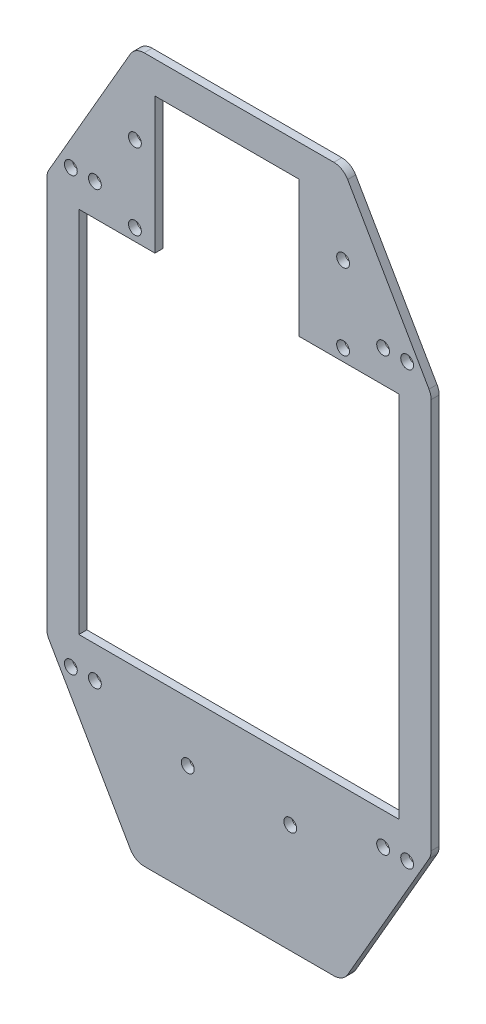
SolidWorks part; units mm, degrees
ref_plane "前视基准面" through (0, 0, 0) normal (0, 0, 1) x (1, 0, 0)
ref_plane "上视基准面" through (0, 0, 0) normal (0, 1, 0) x (1, 0, 0)
ref_plane "右视基准面" through (0, 0, 0) normal (1, 0, 0) x (0, 0, -1)
sketch "草图1" plane through (0, 0, 0) normal (0, 0, 1) x (1, 0, 0)
  line L0 (-98.6603, 121.6667) -> (-56.3212, 195)
  line L1 (47.661, 200) -> (-47.661, 200)
  line L2 (100, 116.6667) -> (100, -116.6667)
  line L3 (47.661, -200) -> (-47.661, -200)
  line L4 (-100, 116.6667) -> (-100, -116.6667)
  line L5 (-118.6603, 127.0257) -> (-67.8682, 215)
  line L6 (59.208, 220) -> (-59.208, 220)
  line L7 (0, 0) -> (0, 150) construction
  line L8 (0, 0) -> (100, 0) construction
  line L9 (98.6603, 121.6667) -> (56.3212, 195)
  line L10 (98.6603, -121.6667) -> (56.3212, -195)
  line L11 (-98.6603, -121.6667) -> (-56.3212, -195)
  line L12 (118.6603, 127.0257) -> (67.8682, 215)
  line L13 (120, 122.0257) -> (120, -122.0257)
  line L14 (118.6603, -127.0257) -> (67.8682, -215)
  line L15 (59.208, -220) -> (-59.208, -220)
  line L16 (-118.6603, -127.0257) -> (-67.8682, -215)
  line L17 (-120, 122.0257) -> (-120, -122.0257)
  line L18 (-120, -124.7051) -> (-64.9815, -220) construction
  line L19 (-120, 124.7051) -> (-120, -124.7051) construction
  line L20 (64.9815, -220) -> (-64.9815, -220) construction
  line L21 (120, -124.7051) -> (64.9815, -220) construction
  line L22 (120, 124.7051) -> (120, -124.7051) construction
  line L23 (-100, -119.3462) -> (-53.4345, -200) construction
  line L24 (53.4345, -200) -> (-53.4345, -200) construction
  line L25 (-100, 119.3462) -> (-100, -119.3462) construction
  line L26 (100, -119.3462) -> (53.4345, -200) construction
  line L27 (100, 119.3462) -> (100, -119.3462) construction
  line L28 (100, 119.3462) -> (53.4345, 200) construction
  line L29 (53.4345, 200) -> (-53.4345, 200) construction
  line L30 (-100, 119.3462) -> (-53.4345, 200) construction
  line L31 (120, 124.7051) -> (64.9815, 220) construction
  line L32 (64.9815, 220) -> (-64.9815, 220) construction
  line L33 (-120, 124.7051) -> (-64.9815, 220) construction
  arc A0 (-118.6603, -127.0257) -> (-120, -122.0257) centre (-110, -122.0257) cw
  arc A1 (-59.208, -220) -> (-67.8682, -215) centre (-59.208, -210) cw
  arc A2 (67.8682, -215) -> (59.208, -220) centre (59.208, -210) cw
  arc A3 (120, -122.0257) -> (118.6603, -127.0257) centre (110, -122.0257) cw
  arc A4 (-56.3212, -195) -> (-47.661, -200) centre (-47.661, -190) ccw
  arc A5 (-98.6603, -121.6667) -> (-100, -116.6667) centre (-90, -116.6667) cw
  arc A6 (56.3212, -195) -> (47.661, -200) centre (47.661, -190) cw
  arc A7 (98.6603, -121.6667) -> (100, -116.6667) centre (90, -116.6667) ccw
  arc A8 (56.3212, 195) -> (47.661, 200) centre (47.661, 190) ccw
  arc A9 (98.6603, 121.6667) -> (100, 116.6667) centre (90, 116.6667) cw
  arc A10 (-56.3212, 195) -> (-47.661, 200) centre (-47.661, 190) cw
  arc A11 (-98.6603, 121.6667) -> (-100, 116.6667) centre (-90, 116.6667) ccw
  arc A12 (118.6603, 127.0257) -> (120, 122.0257) centre (110, 122.0257) cw
  arc A13 (59.208, 220) -> (67.8682, 215) centre (59.208, 210) cw
  arc A14 (-67.8682, 215) -> (-59.208, 220) centre (-59.208, 210) cw
  arc A15 (-118.6603, 127.0257) -> (-120, 122.0257) centre (-110, 122.0257) ccw
  point P0 (0, 0)
  point P37 (-53.4345, -200)
  point P50 (53.4345, 200)
  dimension "D6" = 10
  dimension "D7" = 73.3333
  dimension "D1" = 400
  dimension "D2" = 200
  dimension "D3" = 100
  dimension "D4" = 200
  dimension "D5" = 20
  dimension "D8" = 30
  dimension "D9" = 73.3333
  dimension "D10" = 30
extrude "凸台-拉伸1" add sketch "草图1" along normal blind 30
sketch "草图2" plane through (0, 0, 30) normal (0, 0, 1) x (1, 0, 0)
  line L0 (-100, 130) -> (-70, 130)
  line L1 (-100, 116.6667) -> (-100, -116.6667) construction
  line L2 (-70, 130) -> (-70, 200)
  line L3 (47.661, 200) -> (-47.661, 200) construction
  line L4 (-70, 200) -> (-37.5, 200)
  line L5 (-37.5, 200) -> (-37.5, 115)
  line L6 (-37.5, 115) -> (-100, 115)
  line L7 (-100, 115) -> (-100, 130)
  line L8 (0, 0) -> (0, 200) construction
  dimension "D1" = 15
  dimension "D2" = 32.5
  dimension "D3" = 37.5
  dimension "D4" = 115
extrude "凸台-拉伸2" add sketch "草图2" against normal blind 40
mirror "镜向1" about plane through (0, 0, 0) normal (0, 1, 0) of "凸台-拉伸2"
mirror "镜向2" about plane through (0, 0, 0) normal (1, 0, 0) of "凸台-拉伸2", "镜向1"
sketch "草图3" plane through (0, 0, 0) normal (0, 0, -1) x (-1, 0, 0)
  line L0 (-100, 115) -> (100, 115)
  line L1 (100, 115) -> (100, -115)
  line L2 (100, -115) -> (-100, -115)
  line L3 (-100, -115) -> (-100, 115)
  line L8 (120, -122.0257) -> (120, 122.0257)
  line L10 (120, -122.0257) -> (120, 122.0257)
  line L12 (-120, 122.0257) -> (-120, -122.0257)
  line L13 (-118.6603, -127.0257) -> (-67.8682, -215)
  line L14 (118.6603, 127.0257) -> (67.8682, 215)
  line L20 (-120, 122.0257) -> (-120, -122.0257)
  line L21 (-118.6603, -127.0257) -> (-67.8682, -215)
  line L28 (118.6603, 127.0257) -> (67.8682, 215)
  line L29 (59.208, 220) -> (-59.208, 220)
  line L30 (59.208, 220) -> (-59.208, 220)
  line L31 (-67.8682, 215) -> (-118.6603, 127.0257)
  line L32 (-67.8682, 215) -> (-118.6603, 127.0257)
  line L34 (-59.208, -220) -> (59.208, -220)
  line L36 (-59.208, -220) -> (59.208, -220)
  line L38 (67.8682, -215) -> (118.6603, -127.0257)
  line L40 (67.8682, -215) -> (118.6603, -127.0257)
  arc A8 (118.6603, -127.0257) -> (120, -122.0257) centre (110, -122.0257) ccw
  arc A9 (118.6603, -127.0257) -> (120, -122.0257) centre (110, -122.0257) ccw
  arc A10 (120, 122.0257) -> (118.6603, 127.0257) centre (110, 122.0257) ccw
  arc A11 (120, 122.0257) -> (118.6603, 127.0257) centre (110, 122.0257) ccw
  arc A12 (-118.6603, 127.0257) -> (-120, 122.0257) centre (-110, 122.0257) ccw
  arc A13 (-120, -122.0257) -> (-118.6603, -127.0257) centre (-110, -122.0257) ccw
  arc A14 (67.8682, 215) -> (59.208, 220) centre (59.208, 210) ccw
  arc A15 (67.8682, 215) -> (59.208, 220) centre (59.208, 210) ccw
  arc A20 (-118.6603, 127.0257) -> (-120, 122.0257) centre (-110, 122.0257) ccw
  arc A21 (-120, -122.0257) -> (-118.6603, -127.0257) centre (-110, -122.0257) ccw
  arc A24 (-59.208, 220) -> (-67.8682, 215) centre (-59.208, 210) ccw
  arc A25 (-59.208, 220) -> (-67.8682, 215) centre (-59.208, 210) ccw
  arc A26 (-67.8682, -215) -> (-59.208, -220) centre (-59.208, -210) ccw
  arc A27 (-67.8682, -215) -> (-59.208, -220) centre (-59.208, -210) ccw
  arc A28 (59.208, -220) -> (67.8682, -215) centre (59.208, -210) ccw
  arc A29 (59.208, -220) -> (67.8682, -215) centre (59.208, -210) ccw
  dimension "D1" = 0
extrude "凸台-拉伸3" add sketch "草图3" along normal blind 20
sketch "草图5" plane through (0, 0, -20) normal (0, 0, -1) x (-1, 0, 0)
  line L0 (-67.8682, 215) -> (-67.8682, 310)
  line L1 (-67.8682, 310) -> (67.8682, 310)
  line L2 (67.8682, 310) -> (67.8682, 215)
  line L3 (59.208, 220) -> (-59.208, 220) construction
  line L4 (59.208, 220) -> (-59.208, 220)
  arc A0 (67.8682, 215) -> (59.208, 220) centre (59.208, 210) ccw construction
  arc A1 (-59.208, 220) -> (-67.8682, 215) centre (-59.208, 210) ccw construction
  arc A2 (67.8682, 215) -> (59.208, 220) centre (59.208, 210) ccw
  arc A3 (-59.208, 220) -> (-67.8682, 215) centre (-59.208, 210) ccw
  dimension "D1" = 90
extrude "凸台-拉伸11" add sketch "草图5" against normal blind 15 from offset 10
fillet "圆角3" radius 5 2 edges at (67.8682, 310, -2.5) (-67.8682, 310, -2.5)
sketch "草图6" plane through (0, 0, 0) normal (1, 0, 0) x (0, 0, -1)
  line L0 (-30, 220) -> (-5, 220) construction
  line L1 (17, 221) -> (-5, 221)
  line L2 (17, 221) -> (17, 199)
  line L3 (17, 199) -> (-5, 199)
  line L4 (-5, 221) -> (-5, 199)
  line L5 (17, 221) -> (-5, 199) construction
  line L6 (17, 199) -> (-5, 221) construction
  line L7 (-30, 127.0257) -> (-30, 215) construction
  point P0 (6, 210)
  dimension "D1" = 22
  dimension "D2" = 10
  dimension "D3" = 22
  dimension "D4" = 25
extrude "凸台-拉伸12" add sketch "草图6" along normal mid plane 450
sketch "草图10" plane through (0, 0, 30) normal (0, 0, 1) x (1, 0, 0)
  line L0 (-65, 122.5) -> (-65, 170) construction
  line L2 (-100, 115) -> (-37.5, 115) construction
  dimension "D1" = 65
  dimension "D2" = 7.5
  dimension "D3" = 47.5
hole_wizard "M8x1.0 螺纹孔1" positions "3D草图1" profile "草图11" tap size "M8x1.0" standard "GB"
sketch3d "3D草图1"
  point P0 (-65, 122.5, 30)
  point P3 (-65, 170, 30)
sketch "草图11" plane through (-65, 122.5, 30) normal (1, 0, 0) x (0, -1, 0)
  line L0 (0, 0) -> (0, 23.103)
  line L1 (0, 23.103) -> (3.5, 21)
  line L2 (3.5, 21) -> (3.5, 0)
  line L5 (3.5, 0) -> (0, 0)
  line L10 (0, 23.103) -> (-3.5, 21) construction
  line L11 (0, -6.35) -> (0, 107.95) construction
  dimension "螺纹孔钻头直径" = 7
  dimension "螺纹孔钻头深度" = 21
  dimension "导头角度" = 118
mirror "镜向7" about plane through (0, 0, 0) normal (1, 0, 0) of "M8x1.0 螺纹孔1"
sketch "草图14" plane through (0, 0, 0) normal (0, 0, 1) x (1, 0, 0)
  line L0 (-37.5, 200) -> (37.5, 200)
  line L1 (37.5, 200) -> (37.5, 199)
  line L2 (37.5, 199) -> (-37.5, 199)
  line L3 (-37.5, 199) -> (-37.5, 200)
extrude "切除-拉伸1" cut sketch "草图14" along normal blind 10
mirror "镜向8" about plane through (0, 0, 0) normal (0, 1, 0) of "切除-拉伸1", "凸台-拉伸12", "凸台-拉伸11"
sketch "草图15" plane through (0, 0, 5) normal (0, 0, 1) x (1, 0, 0)
  line L0 (225, 210) -> (191, 210) construction
  line L1 (194, 213) -> (188, 213)
  line L2 (194, 213) -> (194, 207)
  line L3 (194, 207) -> (188, 207)
  line L4 (188, 213) -> (188, 207)
  line L5 (194, 213) -> (188, 207) construction
  line L6 (194, 207) -> (188, 213) construction
  line L7 (225, 221) -> (225, 199) construction
  line L8 (191, 210) -> (176, 210) construction
  line L10 (179, 213) -> (173, 213)
  line L11 (179, 213) -> (179, 207)
  line L12 (179, 207) -> (173, 207)
  line L13 (173, 213) -> (173, 207)
  line L14 (179, 213) -> (173, 207) construction
  line L15 (179, 207) -> (173, 213) construction
  point P0 (191, 210)
  dimension "D1" = 6
  dimension "D2" = 6
  dimension "D3" = 34
  dimension "D4" = 15
  dimension "D5" = 6
  dimension "D6" = 6
sketch "草图16" plane through (0, 0, 5) normal (0, 0, 1) x (1, 0, 0)
  line L0 (135, 199) -> (135, -199)
  line L1 (225, 199) -> (77.1058, 199) construction
  line L2 (225, -199) -> (77.1058, -199) construction
  line L3 (135, -199) -> (77.1058, -199)
  line L4 (77.1058, -199) -> (118.6603, -127.0257)
  line L5 (120, -122.0257) -> (120, 122.0257) construction
  line L6 (120, -122.0257) -> (120, 122.0257)
  line L7 (118.6603, 127.0257) -> (67.8682, 215) construction
  line L8 (118.6603, 127.0257) -> (77.1058, 199)
  line L9 (135, 199) -> (77.1058, 199)
  line L10 (0, 0) -> (0, -200) construction
  line L11 (-37.5, -200) -> (37.5, -200) construction
  line L12 (-135, 199) -> (-77.1058, 199)
  line L13 (-118.6603, 127.0257) -> (-77.1058, 199)
  line L14 (-120, -122.0257) -> (-120, 122.0257)
  line L15 (-77.1058, -199) -> (-118.6603, -127.0257)
  line L16 (-135, -199) -> (-77.1058, -199)
  line L17 (-135, 199) -> (-135, -199)
  arc A0 (118.6603, -127.0257) -> (120, -122.0257) centre (110, -122.0257) ccw construction
  arc A1 (118.6603, -127.0257) -> (120, -122.0257) centre (110, -122.0257) ccw
  arc A2 (120, 122.0257) -> (118.6603, 127.0257) centre (110, 122.0257) ccw construction
  arc A3 (120, 122.0257) -> (118.6603, 127.0257) centre (110, 122.0257) ccw
  arc A4 (-120, 122.0257) -> (-118.6603, 127.0257) centre (-110, 122.0257) cw
  arc A5 (-118.6603, -127.0257) -> (-120, -122.0257) centre (-110, -122.0257) cw
  dimension "D1" = 15
extrude "凸台-拉伸13" add sketch "草图16" against normal blind 20 from offset 1
sketch "草图17" plane through (0, 0, 4) normal (0, 0, 1) x (1, 0, 0)
  line L0 (105.9734, 199) -> (135, 148.7244)
  line L1 (135, 199) -> (77.1058, 199) construction
  line L2 (135, -199) -> (135, 199) construction
  line L3 (135, 148.7244) -> (135, 199)
  line L4 (225, 199) -> (77.1058, 199) construction
  line L5 (135, 199) -> (105.9734, 199)
  line L6 (77.1058, 199) -> (118.6603, 127.0257) construction
  line L7 (118.6603, 127.0257) -> (67.8682, 215) construction
  line L8 (0, 0) -> (308.3014, 0) construction
  line L9 (135, -199) -> (105.9734, -199)
  line L10 (135, -148.7244) -> (135, -199)
  line L11 (105.9734, -199) -> (135, -148.7244)
  line L12 (0, 0) -> (0, -200) construction
  line L13 (-37.5, -200) -> (37.5, -200) construction
  line L14 (-105.9734, -199) -> (-135, -148.7244)
  line L15 (-135, -148.7244) -> (-135, -199)
  line L16 (-135, -199) -> (-105.9734, -199)
  line L17 (-135, 199) -> (-105.9734, 199)
  line L18 (-135, 148.7244) -> (-135, 199)
  line L19 (-105.9734, 199) -> (-135, 148.7244)
  dimension "D1" = 25
extrude "切除-拉伸3" cut sketch "草图17" against normal blind 20
fillet "圆角4" radius 5 8 edges at (105.9734, -199, -6) (135, -148.7244, -6) (135, 148.7244, -6) (105.9734, 199, -6) (-105.9734, 199, -6) (-135, 148.7244, -6) (-135, -148.7244, -6) (-105.9734, -199, -6)
sketch "草图18" plane through (225, 0, 0) normal (1, 0, 0) x (0, 0, -1)
  line L0 (-5, 199) -> (17, 199) construction
  line L1 (8, 203) -> (4, 203)
  line L2 (8, 203) -> (8, 195)
  line L3 (8, 195) -> (4, 195)
  line L4 (4, 203) -> (4, 195)
  line L5 (8, 203) -> (4, 195) construction
  line L6 (8, 195) -> (4, 203) construction
  point P0 (6, 199)
  dimension "D1" = 8
  dimension "D2" = 4
sketch "草图19" plane through (0, 0, 30) normal (0, 0, 1) x (1, 0, 0)
  line L3 (-93.849, 130) -> (-70, 130)
  line L4 (-70, 130) -> (-70, 171.3077)
  line L5 (-70, 171.3077) -> (-93.849, 130)
  line L6 (-93.849, 130) -> (-70, 130)
  line L7 (-70, 130) -> (-70, 171.3077)
  line L8 (-70, 171.3077) -> (-93.849, 130)
  line L9 (93.849, 130) -> (70, 171.3077)
  line L10 (70, 171.3077) -> (70, 130)
  line L11 (70, 130) -> (93.849, 130)
  line L12 (93.849, 130) -> (70, 171.3077)
  line L13 (70, 171.3077) -> (70, 130)
  line L14 (70, 130) -> (93.849, 130)
  line L15 (93.849, -130) -> (70, -130)
  line L16 (70, -130) -> (70, -171.3077)
  line L17 (70, -171.3077) -> (93.849, -130)
  line L18 (93.849, -130) -> (70, -130)
  line L19 (70, -130) -> (70, -171.3077)
  line L20 (70, -171.3077) -> (93.849, -130)
  line L21 (-93.849, -130) -> (-70, -171.3077)
  line L22 (-70, -171.3077) -> (-70, -130)
  line L23 (-70, -130) -> (-93.849, -130)
  line L24 (-93.849, -130) -> (-70, -171.3077)
  line L25 (-70, -171.3077) -> (-70, -130)
  line L26 (-70, -130) -> (-93.849, -130)
  dimension "D1" = 0
  dimension "D2" = 0
  dimension "D3" = 0
  dimension "D4" = 0
extrude "凸台-拉伸14" add sketch "草图19" against normal up to next
sketch "草图20" plane through (0, 0, -20) normal (0, 0, -1) x (-1, 0, 0)
  line L1 (-100, 115) -> (100, 115)
  line L2 (-100, 115) -> (-100, -115)
  line L3 (-100, -115) -> (100, -115)
  line L4 (100, 115) -> (100, -115)
  line L8 (120, -122.0257) -> (120, 122.0257)
  line L9 (118.6603, 127.0257) -> (67.8682, 215)
  line L10 (59.208, 220) -> (-59.208, 220)
  line L11 (-67.8682, 215) -> (-118.6603, 127.0257)
  line L12 (-120, 122.0257) -> (-120, -122.0257)
  line L13 (-118.6603, -127.0257) -> (-67.8682, -215)
  line L14 (-59.208, -220) -> (59.208, -220)
  line L15 (67.8682, -215) -> (118.6603, -127.0257)
  line L16 (120, -122.0257) -> (120, 122.0257)
  line L17 (118.6603, 127.0257) -> (67.8682, 215)
  line L18 (59.208, 220) -> (-59.208, 220)
  line L19 (-67.8682, 215) -> (-118.6603, 127.0257)
  line L20 (-120, 122.0257) -> (-120, -122.0257)
  line L21 (-118.6603, -127.0257) -> (-67.8682, -215)
  line L22 (-59.208, -220) -> (59.208, -220)
  line L23 (67.8682, -215) -> (118.6603, -127.0257)
  arc A8 (118.6603, -127.0257) -> (120, -122.0257) centre (110, -122.0257) ccw
  arc A9 (120, 122.0257) -> (118.6603, 127.0257) centre (110, 122.0257) ccw
  arc A10 (67.8682, 215) -> (59.208, 220) centre (59.208, 210) ccw
  arc A11 (-59.208, 220) -> (-67.8682, 215) centre (-59.208, 210) ccw
  arc A12 (-118.6603, 127.0257) -> (-120, 122.0257) centre (-110, 122.0257) ccw
  arc A13 (-120, -122.0257) -> (-118.6603, -127.0257) centre (-110, -122.0257) ccw
  arc A14 (-67.8682, -215) -> (-59.208, -220) centre (-59.208, -210) ccw
  arc A15 (59.208, -220) -> (67.8682, -215) centre (59.208, -210) ccw
  arc A16 (118.6603, -127.0257) -> (120, -122.0257) centre (110, -122.0257) ccw
  arc A17 (120, 122.0257) -> (118.6603, 127.0257) centre (110, 122.0257) ccw
  arc A18 (67.8682, 215) -> (59.208, 220) centre (59.208, 210) ccw
  arc A19 (-59.208, 220) -> (-67.8682, 215) centre (-59.208, 210) ccw
  arc A20 (-118.6603, 127.0257) -> (-120, 122.0257) centre (-110, 122.0257) ccw
  arc A21 (-120, -122.0257) -> (-118.6603, -127.0257) centre (-110, -122.0257) ccw
  arc A22 (-67.8682, -215) -> (-59.208, -220) centre (-59.208, -210) ccw
  arc A23 (59.208, -220) -> (67.8682, -215) centre (59.208, -210) ccw
  dimension "D1" = 0
extrude "凸台-拉伸15" add sketch "草图20" along normal blind 5
sketch "草图22" plane through (67.8682, 0, 0) normal (1, 0, 0) x (0, 0, -1)
  line L0 (10, 305) -> (10, 221) construction
  line L1 (10, 262) -> (0, 262)
  line L2 (10, 262) -> (10, 290)
  line L3 (10, 290) -> (0, 290)
  line L4 (0, 262) -> (0, 290)
  line L5 (-5, 310) -> (10, 310) construction
  line L6 (0, 264) -> (10, 266)
  line L7 (10, 272) -> (0, 274)
  line L8 (0, 276) -> (10, 276) construction
  line L9 (10, 280) -> (0, 278)
  line L10 (0, 288) -> (10, 286)
  dimension "D1" = 10
  dimension "D2" = 28
  dimension "D3" = 20
  dimension "D4" = 4
  dimension "D5" = 4
  dimension "D6" = 2
  dimension "D7" = 10
sketch "草图24" plane through (0, 0, 0) normal (0, 0, 1) x (1, 0, 0)
  line L4 (-37.5, -115) -> (-37.5, -200)
  line L7 (37.5, -115) -> (-37.5, -115)
  line L11 (37.5, -115) -> (-37.5, -115)
  line L16 (-37.5, -115) -> (-37.5, -200)
  line L19 (-37.5, -200) -> (37.5, -200)
  line L21 (-37.5, -200) -> (37.5, -200)
  line L22 (37.5, -200) -> (37.5, -115)
  line L23 (37.5, -200) -> (37.5, -115)
  dimension "D1" = 0
extrude "凸台-拉伸16" add sketch "草图24" along normal up to surface (30 mm away)
sketch "草图25" plane through (0, -115, 0) normal (0, 1, 0) x (1, 0, 0)
  line L0 (0, -30) -> (0, 22) construction
  line L1 (-100, -30) -> (100, -30) construction
  dimension "D1" = 52
hole_wizard "M8 螺纹孔1" positions "3D草图2" profile "草图26" tap size "M8" standard "GB"
sketch3d "3D草图2"
  point P0 (0, -115, -22)
sketch "草图26" plane through (0, -115, -22) normal (1, 0, 0) x (0, 0, 1)
  line L0 (0, 0) -> (0, 22.0429)
  line L1 (0, 22.0429) -> (3.4, 20)
  line L2 (3.4, 20) -> (3.4, 0)
  line L5 (3.4, 0) -> (0, 0)
  line L10 (0, 22.0429) -> (-3.4, 20) construction
  line L11 (0, -6.35) -> (0, 107.95) construction
  dimension "螺纹孔钻头直径" = 6.8
  dimension "螺纹孔钻头深度" = 20
  dimension "导头角度" = 118
sketch "草图27" plane through (0, 0, 30) normal (0, 0, 1) x (1, 0, 0)
  line L0 (-16, -115) -> (-16, -105)
  line L1 (-100, -115) -> (100, -115) construction
  line L2 (-16, -105) -> (16, -105)
  line L3 (0, -105) -> (0, -111) construction
  line L4 (12, -111) -> (-12, -111)
  line L5 (-12, -111) -> (-12, -115)
  line L6 (-12, -115) -> (-16, -115)
  line L7 (0, 0) -> (0, -105) construction
  line L8 (12, -115) -> (16, -115)
  line L9 (12, -111) -> (12, -115)
  line L10 (16, -115) -> (16, -105)
  dimension "D1" = 6
  dimension "D2" = 10
  dimension "D3" = 12
  dimension "D4" = 16
extrude "凸台-拉伸17" add sketch "草图27" against normal blind 5 from offset 12
pattern_linear "阵列(线性)2" count 2 spacing 26 along (0, 0, -1) of "凸台-拉伸17"
sketch "草图28" plane through (0, 0, 30) normal (0, 0, 1) x (1, 0, 0)
  line L0 (0, -115) -> (0, -152) construction
  line L1 (-100, -115) -> (100, -115) construction
  line L2 (0, -152) -> (-32, -152) construction
  line L3 (0, -152) -> (32, -152) construction
  dimension "D1" = 37
  dimension "D2" = 32
  dimension "D3" = 32
hole_wizard "M8 螺纹孔2" positions "3D草图3" profile "草图29" tap size "M8" standard "GB"
sketch3d "3D草图3"
  point P0 (-32, -152, 30)
  point P3 (32, -152, 30)
sketch "草图29" plane through (-32, -152, 30) normal (1, 0, 0) x (0, -1, 0)
  line L0 (0, 0) -> (0, 24.5429)
  line L1 (0, 24.5429) -> (3.4, 22.5)
  line L2 (3.4, 22.5) -> (3.4, 0)
  line L5 (3.4, 0) -> (0, 0)
  line L10 (0, 24.5429) -> (-3.4, 22.5) construction
  line L11 (0, -6.35) -> (0, 107.95) construction
  dimension "螺纹孔钻头直径" = 6.8
  dimension "螺纹孔钻头深度" = 22.5
  dimension "导头角度" = 118
sketch "草图30" plane through (-67.8682, 0, 0) normal (-1, 0, 0) x (0, 0, 1)
  line L0 (-10, -310) -> (-38.263, -300.579)
  line L1 (-57.2367, -297.5) -> (-125, -297.5)
  line L2 (-127.5, -295) -> (-127.5, -290)
  line L3 (-125, -287.5) -> (-10, -287.5)
  line L4 (-10, -221) -> (-10, -310) construction
  line L5 (-10, -287.5) -> (-10, -310)
  arc A0 (-38.263, -300.579) -> (-57.2367, -297.5) centre (-57.2367, -357.5) ccw
  arc A1 (-127.5, -290) -> (-125, -287.5) centre (-125, -290) cw
  arc A2 (-125, -297.5) -> (-127.5, -295) centre (-125, -295) cw
  point P10 (-47.5, -297.5)
  point P13 (-127.5, -287.5)
  point P16 (-127.5, -297.5)
  dimension "D5" = 60
  dimension "D6" = 2.5
  dimension "D1" = 12.5
  dimension "D2" = 10
  dimension "D3" = 117.5
  dimension "D4" = 80
sketch "草图32" plane through (0, 0, 30) normal (0, 0, 1) x (1, 0, 0)
  line L0 (-37.5, 200) -> (-52.5, 200)
  line L1 (-52.5, 200) -> (-52.5, 115)
  line L2 (-100, 115) -> (-37.5, 115) construction
  line L3 (-52.5, 115) -> (-37.5, 115)
  line L4 (-37.5, 115) -> (-37.5, 200)
  dimension "D1" = 15
extrude "切除-拉伸7" cut sketch "草图32" against normal up to surface (30 mm away)
sketch "草图33" plane through (0, 0, 0) normal (0, 0, 1) x (1, 0, 0)
  line L4 (37.5, 115) -> (37.5, 200)
  line L6 (-52.5, 200) -> (-52.5, 115)
  line L7 (-52.5, 115) -> (37.5, 115)
  line L10 (-52.5, 200) -> (-52.5, 115)
  line L11 (-52.5, 115) -> (37.5, 115)
  line L12 (37.5, 115) -> (37.5, 200)
  line L14 (37.5, 200) -> (-52.5, 200)
  line L15 (37.5, 200) -> (-52.5, 200)
  dimension "D1" = 0
extrude "切除-拉伸8" cut sketch "草图33" against normal blind 12
sketch "草图34" plane through (0, 0, 30) normal (0, 0, 1) x (1, 0, 0)
  line L0 (-100, -115) -> (100, -115) construction
  line L1 (-50, -115) -> (50, -115)
  line L2 (-50, -115) -> (-50, -174)
  line L3 (-50, -174) -> (50, -174)
  line L4 (50, -115) -> (50, -174)
  line L5 (0, -174) -> (0, -220) construction
  line L6 (59.208, -220) -> (-59.208, -220) construction
  dimension "D1" = 100
  dimension "D2" = 59
extrude "切除-拉伸9" cut sketch "草图34" against normal blind 9.25
sketch "草图35" plane through (0, 0, 30) normal (0, 0, 1) x (1, 0, 0)
  line L2 (-175.1264, 290.7759) -> (175.1264, 290.7759)
  line L3 (-175.1264, 290.7759) -> (-175.1264, -290.7759)
  line L4 (-175.1264, -290.7759) -> (175.1264, -290.7759)
  line L5 (175.1264, 290.7759) -> (175.1264, -290.7759)
  line L6 (-175.1264, 290.7759) -> (175.1264, -290.7759) construction
  line L7 (-175.1264, -290.7759) -> (175.1264, 290.7759) construction
  point P2 (0, 0)
extrude "切除-拉伸10" cut sketch "草图35" against normal offset from surface (21 mm away) 5
sketch "草图40" plane through (0, 0, -25) normal (0, 0, -1) x (-1, 0, 0)
  line L1 (-294.8809, 339.2041) -> (294.8809, 339.2041)
  line L2 (-294.8809, 339.2041) -> (-294.8809, -339.2041)
  line L3 (-294.8809, -339.2041) -> (294.8809, -339.2041)
  line L4 (294.8809, 339.2041) -> (294.8809, -339.2041)
  line L5 (-294.8809, 339.2041) -> (294.8809, -339.2041) construction
  line L6 (-294.8809, -339.2041) -> (294.8809, 339.2041) construction
  point P0 (0, 0)
sketch "草图42" plane through (0, 0, -25) normal (0, 0, -1) x (-1, 0, 0)
  line L8 (120, -122.0257) -> (120, 122.0257)
  line L9 (118.6603, 127.0257) -> (67.8682, 215)
  line L10 (59.208, 220) -> (-59.208, 220)
  line L11 (-67.8682, 215) -> (-118.6603, 127.0257)
  line L12 (-120, 122.0257) -> (-120, -122.0257)
  line L13 (-118.6603, -127.0257) -> (-67.8682, -215)
  line L14 (-59.208, -220) -> (59.208, -220)
  line L15 (67.8682, -215) -> (118.6603, -127.0257)
  line L16 (120, -122.0257) -> (120, 122.0257)
  line L17 (118.6603, 127.0257) -> (67.8682, 215)
  line L18 (59.208, 220) -> (-59.208, 220)
  line L19 (-67.8682, 215) -> (-118.6603, 127.0257)
  line L20 (-120, 122.0257) -> (-120, -122.0257)
  line L21 (-118.6603, -127.0257) -> (-67.8682, -215)
  line L22 (-59.208, -220) -> (59.208, -220)
  line L23 (67.8682, -215) -> (118.6603, -127.0257)
  arc A8 (118.6603, -127.0257) -> (120, -122.0257) centre (110, -122.0257) ccw
  arc A9 (120, 122.0257) -> (118.6603, 127.0257) centre (110, 122.0257) ccw
  arc A10 (67.8682, 215) -> (59.208, 220) centre (59.208, 210) ccw
  arc A11 (-59.208, 220) -> (-67.8682, 215) centre (-59.208, 210) ccw
  arc A12 (-118.6603, 127.0257) -> (-120, 122.0257) centre (-110, 122.0257) ccw
  arc A13 (-120, -122.0257) -> (-118.6603, -127.0257) centre (-110, -122.0257) ccw
  arc A14 (-67.8682, -215) -> (-59.208, -220) centre (-59.208, -210) ccw
  arc A15 (59.208, -220) -> (67.8682, -215) centre (59.208, -210) ccw
  arc A16 (118.6603, -127.0257) -> (120, -122.0257) centre (110, -122.0257) ccw
  arc A17 (120, 122.0257) -> (118.6603, 127.0257) centre (110, 122.0257) ccw
  arc A18 (67.8682, 215) -> (59.208, 220) centre (59.208, 210) ccw
  arc A19 (-59.208, 220) -> (-67.8682, 215) centre (-59.208, 210) ccw
  arc A20 (-118.6603, 127.0257) -> (-120, 122.0257) centre (-110, 122.0257) ccw
  arc A21 (-120, -122.0257) -> (-118.6603, -127.0257) centre (-110, -122.0257) ccw
  arc A22 (-67.8682, -215) -> (-59.208, -220) centre (-59.208, -210) ccw
  arc A23 (59.208, -220) -> (67.8682, -215) centre (59.208, -210) ccw
  dimension "D1" = 0
sketch "草图43" plane through (0, 0, -25) normal (0, 0, -1) x (-1, 0, 0)
  line L1 (-227.3114, 369.6277) -> (227.3114, 369.6277)
  line L2 (-227.3114, 369.6277) -> (-227.3114, -369.6277)
  line L3 (-227.3114, -369.6277) -> (227.3114, -369.6277)
  line L4 (227.3114, 369.6277) -> (227.3114, -369.6277)
  line L5 (-227.3114, 369.6277) -> (227.3114, -369.6277) construction
  line L6 (-227.3114, -369.6277) -> (227.3114, 369.6277) construction
  line L8 (120, -122.0257) -> (120, 122.0257)
  line L9 (118.6603, 127.0257) -> (67.8682, 215)
  line L10 (59.208, 220) -> (-59.208, 220)
  line L11 (-67.8682, 215) -> (-118.6603, 127.0257)
  line L12 (-120, 122.0257) -> (-120, -122.0257)
  line L13 (-118.6603, -127.0257) -> (-67.8682, -215)
  line L14 (-59.208, -220) -> (59.208, -220)
  line L15 (67.8682, -215) -> (118.6603, -127.0257)
  line L16 (120, -122.0257) -> (120, 122.0257)
  line L17 (118.6603, 127.0257) -> (67.8682, 215)
  line L18 (59.208, 220) -> (-59.208, 220)
  line L19 (-67.8682, 215) -> (-118.6603, 127.0257)
  line L20 (-120, 122.0257) -> (-120, -122.0257)
  line L21 (-118.6603, -127.0257) -> (-67.8682, -215)
  line L22 (-59.208, -220) -> (59.208, -220)
  line L23 (67.8682, -215) -> (118.6603, -127.0257)
  arc A8 (118.6603, -127.0257) -> (120, -122.0257) centre (110, -122.0257) ccw
  arc A9 (120, 122.0257) -> (118.6603, 127.0257) centre (110, 122.0257) ccw
  arc A10 (67.8682, 215) -> (59.208, 220) centre (59.208, 210) ccw
  arc A11 (-59.208, 220) -> (-67.8682, 215) centre (-59.208, 210) ccw
  arc A12 (-118.6603, 127.0257) -> (-120, 122.0257) centre (-110, 122.0257) ccw
  arc A13 (-120, -122.0257) -> (-118.6603, -127.0257) centre (-110, -122.0257) ccw
  arc A14 (-67.8682, -215) -> (-59.208, -220) centre (-59.208, -210) ccw
  arc A15 (59.208, -220) -> (67.8682, -215) centre (59.208, -210) ccw
  arc A16 (118.6603, -127.0257) -> (120, -122.0257) centre (110, -122.0257) ccw
  arc A17 (120, 122.0257) -> (118.6603, 127.0257) centre (110, 122.0257) ccw
  arc A18 (67.8682, 215) -> (59.208, 220) centre (59.208, 210) ccw
  arc A19 (-59.208, 220) -> (-67.8682, 215) centre (-59.208, 210) ccw
  arc A20 (-118.6603, 127.0257) -> (-120, 122.0257) centre (-110, 122.0257) ccw
  arc A21 (-120, -122.0257) -> (-118.6603, -127.0257) centre (-110, -122.0257) ccw
  arc A22 (-67.8682, -215) -> (-59.208, -220) centre (-59.208, -210) ccw
  arc A23 (59.208, -220) -> (67.8682, -215) centre (59.208, -210) ccw
  point P0 (0, 0)
  dimension "D1" = 0
sketch "草图45" plane through (0, 0, -25) normal (0, 0, -1) x (-1, 0, 0)
  line L1 (-183.5965, 287.6082) -> (183.5965, 287.6082)
  line L2 (-183.5965, 287.6082) -> (-183.5965, -287.6082)
  line L3 (-183.5965, -287.6082) -> (183.5965, -287.6082)
  line L4 (183.5965, 287.6082) -> (183.5965, -287.6082)
  line L5 (-183.5965, 287.6082) -> (183.5965, -287.6082) construction
  line L6 (-183.5965, -287.6082) -> (183.5965, 287.6082) construction
  point P0 (0, 0)
sketch "草图52" plane through (0, 0, 9) normal (0, 0, 1) x (1, 0, 0)
  line L8 (59.208, 220) -> (-59.208, 220)
  line L9 (-67.8682, 215) -> (-118.6603, 127.0257)
  line L10 (-120, 122.0257) -> (-120, -122.0257)
  line L11 (-118.6603, -127.0257) -> (-67.8682, -215)
  line L12 (-59.208, -220) -> (59.208, -220)
  line L13 (67.8682, -215) -> (118.6603, -127.0257)
  line L14 (120, -122.0257) -> (120, 122.0257)
  line L15 (118.6603, 127.0257) -> (67.8682, 215)
  line L16 (59.208, 220) -> (-59.208, 220)
  line L17 (-67.8682, 215) -> (-118.6603, 127.0257)
  line L18 (-120, 122.0257) -> (-120, -122.0257)
  line L19 (-118.6603, -127.0257) -> (-67.8682, -215)
  line L20 (-59.208, -220) -> (59.208, -220)
  line L21 (67.8682, -215) -> (118.6603, -127.0257)
  line L22 (120, -122.0257) -> (120, 122.0257)
  line L23 (118.6603, 127.0257) -> (67.8682, 215)
  arc A8 (-59.208, 220) -> (-67.8682, 215) centre (-59.208, 210) ccw
  arc A9 (-118.6603, 127.0257) -> (-120, 122.0257) centre (-110, 122.0257) ccw
  arc A10 (-120, -122.0257) -> (-118.6603, -127.0257) centre (-110, -122.0257) ccw
  arc A11 (-67.8682, -215) -> (-59.208, -220) centre (-59.208, -210) ccw
  arc A12 (59.208, -220) -> (67.8682, -215) centre (59.208, -210) ccw
  arc A13 (118.6603, -127.0257) -> (120, -122.0257) centre (110, -122.0257) ccw
  arc A14 (120, 122.0257) -> (118.6603, 127.0257) centre (110, 122.0257) ccw
  arc A15 (67.8682, 215) -> (59.208, 220) centre (59.208, 210) ccw
  arc A16 (-59.208, 220) -> (-67.8682, 215) centre (-59.208, 210) ccw
  arc A17 (-118.6603, 127.0257) -> (-120, 122.0257) centre (-110, 122.0257) ccw
  arc A18 (-120, -122.0257) -> (-118.6603, -127.0257) centre (-110, -122.0257) ccw
  arc A19 (-67.8682, -215) -> (-59.208, -220) centre (-59.208, -210) ccw
  arc A20 (59.208, -220) -> (67.8682, -215) centre (59.208, -210) ccw
  arc A21 (118.6603, -127.0257) -> (120, -122.0257) centre (110, -122.0257) ccw
  arc A22 (120, 122.0257) -> (118.6603, 127.0257) centre (110, 122.0257) ccw
  arc A23 (67.8682, 215) -> (59.208, 220) centre (59.208, 210) ccw
  dimension "D1" = 0
sketch "草图53" plane through (0, 0, 9) normal (0, 0, 1) x (1, 0, 0)
  line L1 (-373.4967, 367.981) -> (373.4967, 367.981)
  line L2 (-373.4967, 367.981) -> (-373.4967, -367.981)
  line L3 (-373.4967, -367.981) -> (373.4967, -367.981)
  line L4 (373.4967, 367.981) -> (373.4967, -367.981)
  line L5 (-373.4967, 367.981) -> (373.4967, -367.981) construction
  line L6 (-373.4967, -367.981) -> (373.4967, 367.981) construction
  point P0 (0, 0)
extrude "切除-拉伸26" cut sketch "草图53" against normal blind 110 from offset 5
sketch "草图54" plane through (0, 0, 9) normal (0, 0, 1) x (1, 0, 0)
  line L8 (59.208, 220) -> (-59.208, 220)
  line L9 (-67.8682, 215) -> (-118.6603, 127.0257)
  line L10 (-120, 122.0257) -> (-120, -122.0257)
  line L11 (-118.6603, -127.0257) -> (-67.8682, -215)
  line L12 (-59.208, -220) -> (59.208, -220)
  line L13 (67.8682, -215) -> (118.6603, -127.0257)
  line L14 (120, -122.0257) -> (120, 122.0257)
  line L15 (118.6603, 127.0257) -> (67.8682, 215)
  line L16 (59.208, 220) -> (-59.208, 220)
  line L17 (-67.8682, 215) -> (-118.6603, 127.0257)
  line L18 (-120, 122.0257) -> (-120, -122.0257)
  line L19 (-118.6603, -127.0257) -> (-67.8682, -215)
  line L20 (-59.208, -220) -> (59.208, -220)
  line L21 (67.8682, -215) -> (118.6603, -127.0257)
  line L22 (120, -122.0257) -> (120, 122.0257)
  line L23 (118.6603, 127.0257) -> (67.8682, 215)
  arc A8 (-59.208, 220) -> (-67.8682, 215) centre (-59.208, 210) ccw
  arc A9 (-118.6603, 127.0257) -> (-120, 122.0257) centre (-110, 122.0257) ccw
  arc A10 (-120, -122.0257) -> (-118.6603, -127.0257) centre (-110, -122.0257) ccw
  arc A11 (-67.8682, -215) -> (-59.208, -220) centre (-59.208, -210) ccw
  arc A12 (59.208, -220) -> (67.8682, -215) centre (59.208, -210) ccw
  arc A13 (118.6603, -127.0257) -> (120, -122.0257) centre (110, -122.0257) ccw
  arc A14 (120, 122.0257) -> (118.6603, 127.0257) centre (110, 122.0257) ccw
  arc A15 (67.8682, 215) -> (59.208, 220) centre (59.208, 210) ccw
  arc A16 (-59.208, 220) -> (-67.8682, 215) centre (-59.208, 210) ccw
  arc A17 (-118.6603, 127.0257) -> (-120, 122.0257) centre (-110, 122.0257) ccw
  arc A18 (-120, -122.0257) -> (-118.6603, -127.0257) centre (-110, -122.0257) ccw
  arc A19 (-67.8682, -215) -> (-59.208, -220) centre (-59.208, -210) ccw
  arc A20 (59.208, -220) -> (67.8682, -215) centre (59.208, -210) ccw
  arc A21 (118.6603, -127.0257) -> (120, -122.0257) centre (110, -122.0257) ccw
  arc A22 (120, 122.0257) -> (118.6603, 127.0257) centre (110, 122.0257) ccw
  arc A23 (67.8682, 215) -> (59.208, 220) centre (59.208, 210) ccw
  dimension "D1" = 0
extrude "切除-拉伸27" cut sketch "草图54" against normal blind 110 flip side to cut
sketch "草图57" plane through (0, 0, 9) normal (0, 0, 1) x (1, 0, 0)
  circle A0 centre (65, 122.5) radius 4
  circle A1 centre (65, 170) radius 4
  circle A2 centre (32, -152) radius 4
  dimension "D1" = 8
  dimension "D2" = 8
  dimension "D3" = 8
extrude "切除-拉伸28" cut sketch "草图57" against normal blind 10
mirror "镜向9" about plane through (0, 0, 0) normal (1, 0, 0) of "切除-拉伸28"
sketch "草图59" plane through (0, 0, 9) normal (0, 0, 1) x (1, 0, 0)
  line L0 (-120, 122.0257) -> (-120, -122.0257) construction
  line L1 (-105, -135) -> (-90, -135) construction
  line L2 (100, -115) -> (-100, -115) construction
  circle A0 centre (-105, -135) radius 4
  circle A1 centre (-90, -135) radius 4
  dimension "D1" = 8
  dimension "D2" = 15
  dimension "D3" = 20
  dimension "D4" = 15
extrude "切除-拉伸29" cut sketch "草图59" against normal blind 10
mirror "镜向10" about plane through (0, 0, 0) normal (1, 0, 0) of "切除-拉伸29"
mirror "镜向11" about plane through (0, 0, 0) normal (0, 1, 0) of "镜向10", "切除-拉伸29"
equation "\"F\"=542"
